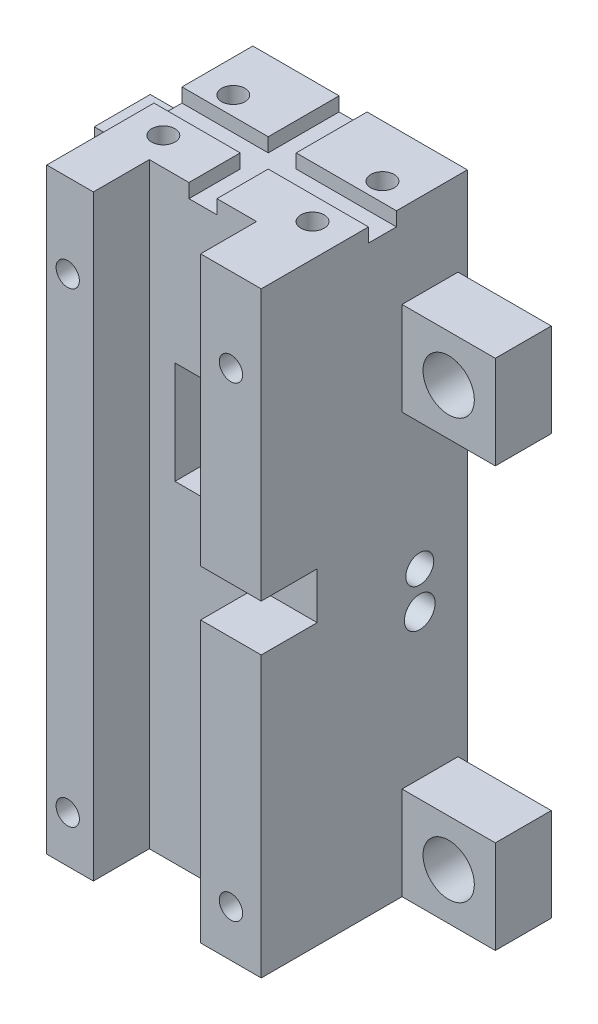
SolidWorks part; units mm, degrees
ref_plane "前视基准面" through (0, 0, 0) normal (0, 0, 1) x (1, 0, 0)
ref_plane "上视基准面" through (0, 0, 0) normal (0, 1, 0) x (1, 0, 0)
ref_plane "右视基准面" through (0, 0, 0) normal (1, 0, 0) x (0, 0, -1)
sketch "草图1" plane through (0, 0, 0) normal (0, 0, 1) x (1, 0, 0)
  line L1 (-105.8885, 13.1822) -> (-82.8885, 13.1822)
  line L2 (-105.8885, 13.1822) -> (-105.8885, -56.8178)
  line L3 (-105.8885, -56.8178) -> (-82.8885, -56.8178)
  line L4 (-82.8885, 13.1822) -> (-82.8885, -56.8178)
  dimension "D1" = 70
  dimension "D2" = 23
extrude "凸台-拉伸1" add sketch "草图1" along normal blind 20.1
sketch "草图2" plane through (-82.8885, 0, 0) normal (1, 0, 0) x (0, 0, -1)
  line L0 (-20.1, -56.8178) -> (-20.1, 13.1822) construction
  line L1 (-20.1, -26.8178) -> (-14.1, -26.8178)
  line L2 (-20.1, -26.8178) -> (-20.1, -21.8178)
  line L3 (-20.1, -21.8178) -> (-14.1, -21.8178)
  line L4 (-14.1, -26.8178) -> (-14.1, -21.8178)
  line L5 (-20.1, 13.1822) -> (0, 13.1822) construction
  dimension "D1" = 5
  dimension "D2" = 6
  dimension "D4" = 40
extrude "切除-拉伸1" cut sketch "草图2" against normal blind 18
sketch "草图3" plane through (0, 0, 20.1) normal (0, 0, 1) x (1, 0, 0)
  line L0 (-82.8885, 13.1822) -> (-105.8885, 13.1822) construction
  line L1 (-100.8885, -56.8178) -> (-89.3885, -56.8178)
  line L2 (-100.8885, -56.8178) -> (-100.8885, 13.1822)
  line L3 (-100.8885, 13.1822) -> (-89.3885, 13.1822)
  line L4 (-89.3885, -56.8178) -> (-89.3885, 13.1822)
  line L5 (-105.8885, -56.8178) -> (-82.8885, -56.8178) construction
  line L6 (-82.8885, -21.8178) -> (-82.8885, 13.1822) construction
  dimension "D1" = 11.5
  dimension "D2" = 6.5
extrude "切除-拉伸2" cut sketch "草图3" against normal up to surface (6 mm away)
sketch "草图4" plane through (-105.8885, 0, 0) normal (-1, 0, 0) x (0, 0, 1)
  line L0 (20.1, 13.1822) -> (0, 13.1822) construction
  line L1 (14.1, 13.1822) -> (20.1, 13.1822)
  line L2 (14.1, 13.1822) -> (14.1, 10.1822)
  line L3 (14.1, 10.1822) -> (20.1, 10.1822)
  line L4 (20.1, 13.1822) -> (20.1, 10.1822)
  line L5 (14.1, -21.8178) -> (14.1, 13.1822) construction
  dimension "D1" = 6
  dimension "D2" = 3
extrude "凸台-拉伸2" add sketch "草图4" along normal blind 27
sketch "草图5" plane through (-132.8885, 0, 0) normal (-1, 0, 0) x (0, 0, 1)
  line L1 (20.1, 13.1822) -> (18.6, 13.1822)
  line L2 (20.1, 13.1822) -> (20.1, 10.1822)
  line L3 (20.1, 10.1822) -> (18.6, 10.1822)
  line L4 (18.6, 13.1822) -> (18.6, 10.1822)
  line L5 (15.6, 10.1822) -> (14.1, 10.1822)
  line L6 (15.6, 10.1822) -> (15.6, 13.1822)
  line L7 (15.6, 13.1822) -> (14.1, 13.1822)
  line L8 (14.1, 10.1822) -> (14.1, 13.1822)
extrude "切除-拉伸3" cut sketch "草图5" against normal up to surface (27 mm away)
sketch "草图6" plane through (-132.8885, 0, 0) normal (-1, 0, 0) x (0, 0, 1)
  line L0 (17.1, 13.1822) -> (17.1, 9.1822) construction
  line L1 (18.6, 13.1822) -> (15.6, 13.1822) construction
  circle A0 centre (17.1, 9.1822) radius 2
  dimension "D1" = 4
  dimension "D2" = 4
extrude "切除-拉伸4" cut sketch "草图6" against normal blind 5
sketch "草图11" plane through (0, 0, 20.1) normal (0, 0, 1) x (1, 0, 0)
  line L0 (-132.8885, 13.1822) -> (-132.8885, 10.5051) construction
  line L1 (-82.8885, 13.1822) -> (-132.8885, 13.1822)
  line L2 (-82.8885, 13.1822) -> (-82.8885, 7.1822)
  line L3 (-82.8885, 7.1822) -> (-132.8885, 7.1822)
  line L4 (-132.8885, 13.1822) -> (-132.8885, 7.1822)
  dimension "D1" = 6
extrude "切除-拉伸5" cut sketch "草图11" against normal through all
sketch "草图12" plane through (0, 0, 14.1) normal (0, 0, 1) x (1, 0, 0)
  line L0 (-89.3885, 7.1822) -> (-100.8885, 7.1822) construction
  line L1 (-93.6385, 5.6822) -> (-96.6385, 5.6822)
  line L2 (-93.6385, 5.6822) -> (-93.6385, 7.1822)
  line L3 (-93.6385, 7.1822) -> (-96.6385, 7.1822)
  line L4 (-96.6385, 5.6822) -> (-96.6385, 7.1822)
  line L5 (-96.6385, 5.6822) -> (-96.6385, 7.1822) construction
extrude "切除-拉伸6" cut sketch "草图12" against normal through all
sketch "草图14" plane through (-82.8885, 0, 0) normal (1, 0, 0) x (0, 0, -1)
  line L0 (0, 7.1822) -> (-20.1, 7.1822) construction
  line L1 (-8.6, 5.6822) -> (-5.6, 5.6822)
  line L2 (-8.6, 5.6822) -> (-8.6, 7.1822)
  line L3 (-8.6, 7.1822) -> (-5.6, 7.1822)
  line L4 (-5.6, 5.6822) -> (-5.6, 7.1822)
  line L5 (-5.6, 5.6822) -> (-5.6, 7.1822) construction
extrude "切除-拉伸7" cut sketch "草图14" against normal through all
hole_wizard "M3 螺纹孔2" positions "草图16" profile "草图15" tap size "M3" standard "Iso"
sketch "草图16" plane through (0, 7.1822, 0) normal (0, 1, 0) x (1, 0, 0)
  point P0 (-86.3885, -11.1)
  point P3 (-102.3885, -11.1)
  point P6 (-102.3885, -3.6)
  point P9 (-86.3885, -3.6)
sketch "草图15" plane through (-86.3885, 7.1822, 11.1) normal (1, 0, 0) x (0, 0, 1)
  line L0 (0, 0) -> (0, 8.7511)
  line L1 (0, 8.7511) -> (1.25, 8)
  line L2 (1.25, 8) -> (1.25, 0)
  line L5 (1.25, 0) -> (0, 0)
  line L10 (0, 8.7511) -> (-1.25, 8) construction
  line L11 (0, -6.35) -> (0, 107.95) construction
  dimension "螺纹孔钻头直径" = 2.5
  dimension "螺纹孔钻头深度" = 8
  dimension "导头角度" = 118
hole_wizard "M3 螺纹孔3" positions "草图18" profile "草图17" tap size "M3" standard "Iso"
sketch "草图18" plane through (0, 0, 20.1) normal (0, 0, 1) x (1, 0, 0)
  point P0 (-86.1385, -1.8178)
  point P3 (-103.6385, -1.8178)
  point P6 (-86.1385, -51.8178)
  point P9 (-103.6385, -51.8178)
  dimension "D1" = 17.5
  dimension "D2" = 50
sketch "草图17" plane through (-86.1385, -1.8178, 20.1) normal (1, 0, 0) x (0, -1, 0)
  line L0 (0, 0) -> (0, 8.7511)
  line L1 (0, 8.7511) -> (1.25, 8)
  line L2 (1.25, 8) -> (1.25, 0)
  line L5 (1.25, 0) -> (0, 0)
  line L10 (0, 8.7511) -> (-1.25, 8) construction
  line L11 (0, -6.35) -> (0, 107.95) construction
  dimension "螺纹孔钻头直径" = 2.5
  dimension "螺纹孔钻头深度" = 8
  dimension "导头角度" = 118
sketch "草图19" plane through (0, 0, 0) normal (0, 0, -1) x (-1, 0, 0)
  line L8 (96.6385, 5.6822) -> (93.6385, 5.6822)
  line L9 (93.6385, 5.6822) -> (93.6385, 7.1822)
  line L10 (93.6385, 7.1822) -> (82.8885, 7.1822)
  line L11 (82.8885, 7.1822) -> (82.8885, -56.8178)
  line L12 (82.8885, -56.8178) -> (105.8885, -56.8178)
  line L13 (105.8885, -56.8178) -> (105.8885, 7.1822)
  line L14 (105.8885, 7.1822) -> (96.6385, 7.1822)
  line L15 (96.6385, 7.1822) -> (96.6385, 5.6822)
  line L16 (96.6385, 5.6822) -> (93.6385, 5.6822)
  line L17 (93.6385, 5.6822) -> (93.6385, 7.1822)
  line L18 (93.6385, 7.1822) -> (82.8885, 7.1822)
  line L19 (82.8885, 7.1822) -> (82.8885, -56.8178)
  line L20 (82.8885, -56.8178) -> (105.8885, -56.8178)
  line L21 (105.8885, -56.8178) -> (105.8885, 7.1822)
  line L22 (105.8885, 7.1822) -> (96.6385, 7.1822)
  line L23 (96.6385, 7.1822) -> (96.6385, 5.6822)
  dimension "D1" = 0
extrude "凸台-拉伸3" add sketch "草图19" along normal blind 2
sketch "草图21" plane through (0, 0, 14.1) normal (0, 0, 1) x (1, 0, 0)
  line L1 (-100.8885, -5.8534) -> (-89.3885, -5.8534) construction
  line L2 (-98.1385, -21.3178) -> (-92.1385, -21.3178)
  line L3 (-98.1385, -21.3178) -> (-98.1385, -10.3178)
  line L4 (-98.1385, -10.3178) -> (-92.1385, -10.3178)
  line L5 (-92.1385, -21.3178) -> (-92.1385, -10.3178)
  line L7 (-100.8885, 7.1822) -> (-100.8885, -56.8178) construction
  line L8 (-89.3885, -21.8178) -> (-89.3885, 7.1822) construction
  line L9 (-95.1385, -5.8534) -> (-95.1385, 2.9812) construction
  line L10 (-89.3885, -21.8178) -> (-82.8885, -21.8178) construction
  point P12 (-95.1385, -10.3178)
  dimension "D1" = 6
  dimension "D2" = 11
  dimension "D3" = 0.5
extrude "切除-拉伸9" cut sketch "草图21" against normal through all
sketch "草图22" plane through (0, 0, -2) normal (0, 0, -1) x (-1, 0, 0)
  line L0 (82.8885, -56.8178) -> (105.8885, -56.8178) construction
  line L1 (98.1385, -21.3178) -> (92.1385, -21.3178)
  line L2 (98.1385, -21.3178) -> (98.1385, -56.8178)
  line L3 (98.1385, -56.8178) -> (92.1385, -56.8178)
  line L4 (92.1385, -21.3178) -> (92.1385, -56.8178)
extrude "切除-拉伸10" cut sketch "草图22" against normal blind 10
sketch "草图23" plane through (-82.8885, 0, 0) normal (1, 0, 0) x (0, 0, -1)
  line L0 (2, 7.1822) -> (-5.6, 7.1822) construction
  line L1 (-20.1, -21.8178) -> (-20.1, 7.1822) construction
  circle A0 centre (-3.1, -27.3178) radius 1.5
  dimension "D1" = 34.5
  dimension "D3" = 3
  dimension "D2" = 17
extrude "切除-拉伸11" cut sketch "草图23" against normal through all
sketch "草图24" plane through (0, 0, 8) normal (0, 0, -1) x (-1, 0, 0)
  line L0 (95.1385, -56.8178) -> (95.1385, 5.6822) construction
  line L1 (92.1385, -56.8178) -> (98.1385, -56.8178) construction
  line L2 (96.6385, 5.6822) -> (93.6385, 5.6822) construction
  circle A0 centre (95.1385, -33.3178) radius 2.4
  dimension "D1" = 4.8
  dimension "D2" = 23.5
extrude "切除-拉伸12" cut sketch "草图24" against normal blind 2
hole_wizard "M4 螺纹孔1" positions "草图26" profile "草图25" tap size "M4" standard "Iso"
sketch "草图26" plane through (-105.8885, 0, 0) normal (-1, 0, 0) x (0, 0, 1)
  line L0 (3.1, -27.3178) -> (3.1, -56.8178) construction
  line L1 (20.1, -56.8178) -> (-2, -56.8178) construction
  line L2 (20.1, 7.1822) -> (8.6, 7.1822) construction
  point P0 (3.1, -31.3178)
  dimension "D1" = 38.5
sketch "草图25" plane through (-105.8885, -31.3178, 3.1) normal (0, 1, 0) x (0, 0, 1)
  line L0 (0, 0) -> (0, 8.7404)
  line L1 (0, 8.7404) -> (1.65, 7.749)
  line L2 (1.65, 7.749) -> (1.65, 0)
  line L5 (1.65, 0) -> (0, 0)
  line L10 (0, 8.7404) -> (-1.65, 7.749) construction
  line L11 (0, -6.35) -> (0, 107.95) construction
  dimension "螺纹孔钻头直径" = 3.3
  dimension "螺纹孔钻头深度" = 7.749
  dimension "导头角度" = 118
hole_wizard "M4 螺纹孔2" positions "草图29" profile "草图28" tap size "M4" standard "Iso"
sketch "草图29" plane through (-82.8885, 0, 0) normal (1, 0, 0) x (0, 0, -1)
  point P0 (-3.1, -31.3178)
sketch "草图28" plane through (-82.8885, -31.3178, 3.1) normal (0, 1, 0) x (0, 0, -1)
  line L0 (0, 0) -> (0, 10.2404)
  line L1 (0, 10.2404) -> (1.65, 9.249)
  line L2 (1.65, 9.249) -> (1.65, 0)
  line L5 (1.65, 0) -> (0, 0)
  line L10 (0, 10.2404) -> (-1.65, 9.249) construction
  line L11 (0, -6.35) -> (0, 107.95) construction
  dimension "螺纹孔钻头直径" = 3.3
  dimension "螺纹孔钻头深度" = 9.249
  dimension "导头角度" = 118
sketch "草图30" plane through (-105.8885, 0, 0) normal (-1, 0, 0) x (0, 0, 1)
  line L1 (-1, -56.8178) -> (5, -56.8178)
  line L2 (-1, -56.8178) -> (-1, -46.8178)
  line L3 (-1, -46.8178) -> (5, -46.8178)
  line L4 (5, -56.8178) -> (5, -46.8178)
  line L5 (-1, -1.8178) -> (5, -1.8178)
  line L6 (-1, -1.8178) -> (-1, -11.8178)
  line L7 (-1, -11.8178) -> (5, -11.8178)
  line L8 (5, -1.8178) -> (5, -11.8178)
  line L10 (-2, -56.8178) -> (-2, 7.1822) construction
  line L11 (20.1, -56.8178) -> (-2, -56.8178) construction
  dimension "D1" = 6
  dimension "D2" = 10
  dimension "D3" = 1
  dimension "D4" = 35
extrude "凸台-拉伸4" add sketch "草图30" along normal blind 10
ref_plane "基准面2" through (-94.3885, 0, 0) normal (-1, 0, 0) x (0, 0, 1)
mirror "镜向2" about plane through (-94.3885, 0, 0) normal (-1, 0, 0) of "凸台-拉伸4"
hole_wizard "Ø5.5 (5.5) 直径孔1" positions "草图34" profile "草图33" hole size "Ø5.5" standard "Iso"
sketch "草图34" plane through (0, 0, 5) normal (0, 0, 1) x (1, 0, 0)
  line L0 (-110.8885, -1.8178) -> (-110.8885, -11.8178) construction
  line L1 (-115.8885, -1.8178) -> (-105.8885, -1.8178) construction
  line L2 (-115.8885, -11.8178) -> (-105.8885, -11.8178) construction
  line L3 (-110.8885, -46.8178) -> (-110.8885, -56.8178) construction
  line L4 (-115.8885, -46.8178) -> (-105.8885, -46.8178) construction
  line L5 (-115.8885, -56.8178) -> (-105.8885, -56.8178) construction
  point P0 (-110.8885, -6.8178)
  point P2 (-110.8885, -51.8178)
sketch "草图33" plane through (-110.8885, -6.8178, 5) normal (1, 0, 0) x (0, -1, 0)
  line L0 (0, 0) -> (0, 7)
  line L1 (0, 7) -> (2.75, 7)
  line L2 (2.75, 7) -> (2.75, 0)
  line L5 (2.75, 0) -> (0, 0)
  line L11 (0, -6.35) -> (0, 107.95) construction
  dimension "通孔孔直径" = 5.5
  dimension "通孔孔深度" = 7
mirror "镜向3" about plane through (-94.3885, 0, 0) normal (-1, 0, 0) of "Ø5.5 (5.5) 直径孔1"
